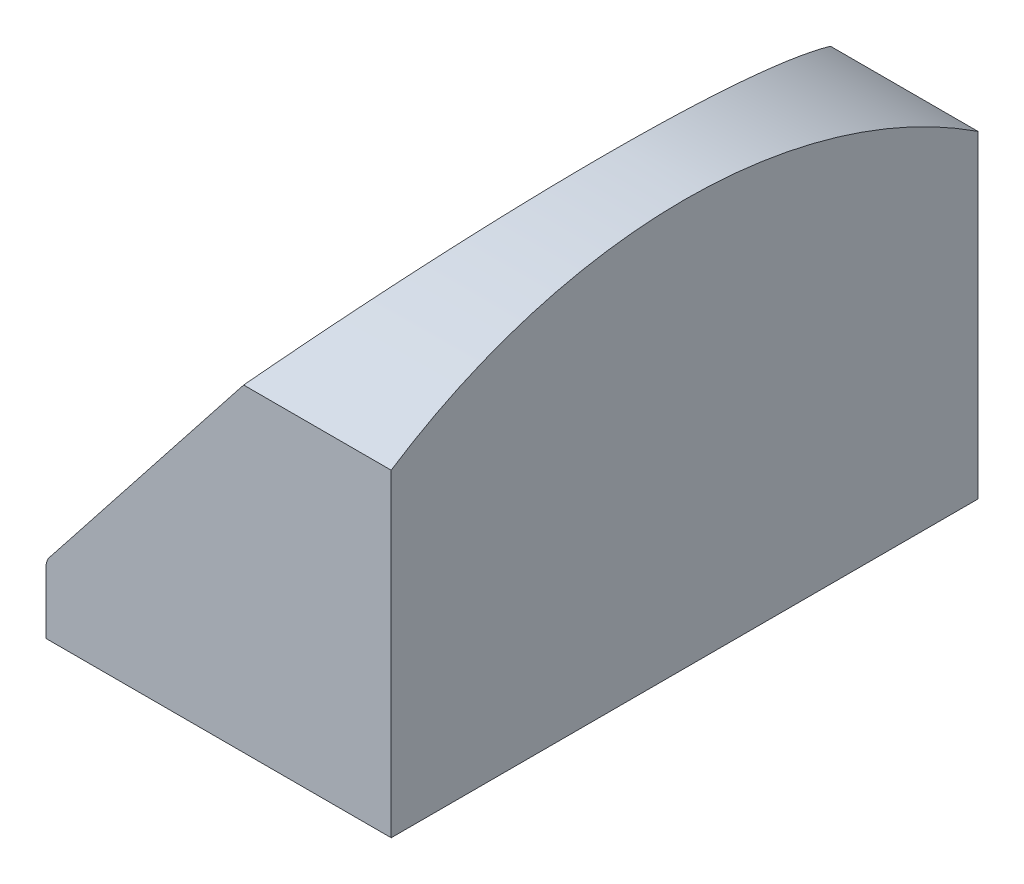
SolidWorks part; units mm, degrees
ref_plane "Plan de face" through (0, 0, 0) normal (0, 0, 1) x (1, 0, 0)
ref_plane "Plan de dessus" through (0, 0, 0) normal (0, 1, 0) x (1, 0, 0)
ref_plane "Plan de droite" through (0, 0, 0) normal (1, 0, 0) x (0, 0, -1)
sketch "Esquisse2" plane through (0, 0, 0) normal (0, 0, 1) x (1, 0, 0)
  line L0 (0, 0) -> (10, 0)
  line L1 (10, 0) -> (10, 11.8)
  line L2 (10, 11.8) -> (7.7569, 11.8)
  line L3 (0, 1.7899) -> (0, 0)
  line L4 (7.7569, 11.8) -> (0.15, 2.147)
  arc A1 (0, 1.7899) -> (0.15, 2.147) centre (0.5, 1.7899) cw
  point P7 (10, 11.8)
  point P10 (0, 2)
  dimension "D1" = 10
  dimension "D2" = 11.8
  dimension "D3" = 2
extrude "Extrusion2" add sketch "Esquisse2" along normal blind 17
sketch "Esquisse3" plane through (10, 0, 0) normal (1, 0, 0) x (0, 0, -1)
  line L0 (-17, 9.2226) -> (-18.5582, 11.9309)
  line L1 (-17.6455, 14.909) -> (3.8058, 12.2476)
  line L2 (-17, 0) -> (-17, 11.8) construction
  line L3 (-18.5582, 11.9309) -> (-17.6455, 14.909)
  line L4 (-17, 0) -> (-17, 11.8) construction
  line L5 (0, 0) -> (0, 11.8) construction
  line L6 (0, 9.2226) -> (3.8058, 12.2476)
  line L7 (0, 0) -> (0, 11.8) construction
  arc A0 (-17, 9.2226) -> (0, 9.2226) centre (-8.5, -3.7425) cw
extrude "Enlèv. mat.-Extru.1" cut sketch "Esquisse3" against normal through all
sketch "Esquisse4" plane through (-0.9512, 0.7496, 0) normal (-0.7854, 0.6189, 0) x (0, 0, 1)
  line L6 (16, 10.7878) -> (16, 2.7792)
  line L7 (16, 2.7792) -> (1, 2.7792)
  line L8 (1, 10.7878) -> (1, 2.7792)
  arc A0 (1, 10.7878) -> (16, 10.7878) centre (8.5, 1.1678) cw
extrude "Enlèv. mat.-Extru.2" cut sketch "Esquisse4" against normal blind 0.5
sketch "Esquisse5" plane through (-0.5585, 0.4401, 0) normal (-0.7854, 0.6189, 0) x (0, 0, 1)
  line L0 (12.2611, 7.5739) -> (11.4161, 7.7161)
  line L1 (8.8804, 7.7464) -> (6.4986, 7.7464)
  line L2 (9.6322, 7.7464) -> (9.6322, 5.2654)
  line L3 (9.6322, 5.2654) -> (6.4986, 5.2654)
  line L4 (6.4986, 7.7464) -> (6.4986, 5.2654)
  line L6 (7.6295, 6.3174) -> (8.1398, 6.3174)
  line L7 (7.6295, 6.3174) -> (7.6295, 5.7771)
  line L8 (7.6295, 5.7771) -> (8.1398, 5.7771)
  line L9 (8.1398, 6.3174) -> (8.1398, 5.7771)
  arc A0 (9.6322, 7.7464) -> (11.4161, 7.7161) centre (10.5165, 7.2794) cw
  arc A1 (8.8804, 7.7464) -> (12.2611, 7.5739) centre (10.5165, 6.596) cw
  dimension "D1" = 2
  dimension "D2" = 1
extrude "Extrusion3" add sketch "Esquisse5" along normal blind 0.2
